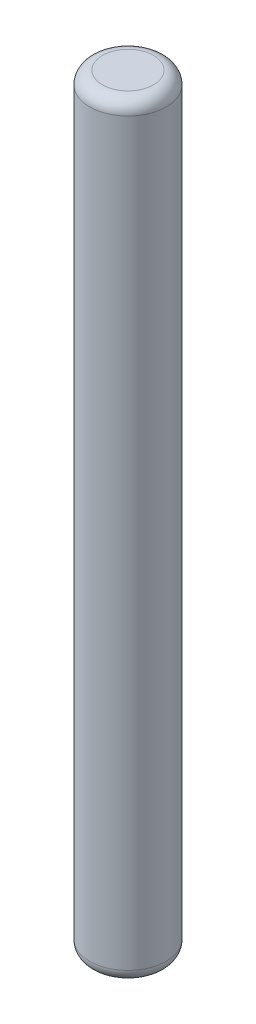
SolidWorks part; units mm, degrees
ref_plane "Спереди" through (0, 0, 0) normal (0, 0, 1) x (1, 0, 0)
ref_plane "Сверху" through (0, 0, 0) normal (0, 1, 0) x (1, 0, 0)
ref_plane "Справа" through (0, 0, 0) normal (1, 0, 0) x (0, 0, -1)
sketch "Эскиз1" plane through (0, 0, 0) normal (0, 1, 0) x (1, 0, 0)
  circle A0 centre (0, 0) radius 0.75
  dimension "D1" = 1.5
extrude "Бобышка-Вытянуть1" add sketch "Эскиз1" along normal mid plane 15
fillet "Скругление1" radius 0.25 2 edges at (0, -7.5, 0.75) (0, 7.5, 0.75)
